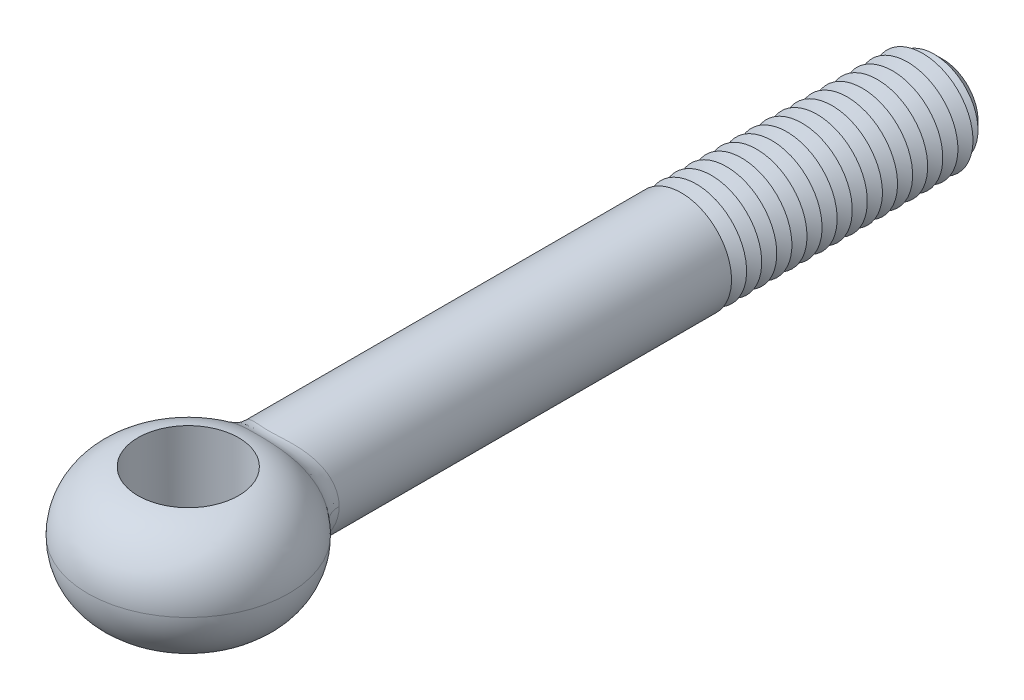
SolidWorks part; units mm, degrees
ref_plane "Front Plane" through (0, 0, 0) normal (0, 0, 1) x (1, 0, 0)
ref_plane "Top Plane" through (0, 0, 0) normal (0, 1, 0) x (1, 0, 0)
ref_plane "Right Plane" through (0, 0, 0) normal (1, 0, 0) x (0, 0, -1)
sketch "Sketch7" plane through (0, 0, 0) normal (0, 1, 0) x (1, 0, 0)
  circle A0 centre (0, 0) radius 10
  dimension "D1" = 20
extrude "Boss-Extrude3" add sketch "Sketch7" along normal mid plane 12
sketch "Sketch8" plane through (0, 0, 0) normal (0, 0, 1) x (1, 0, 0)
  circle A0 centre (0, 0) radius 5
  dimension "D1" = 10
extrude "Boss-Extrude4" add sketch "Sketch8" against normal blind 75
fillet "Fillet5" radius 6 2 edges at (0, -6, 10) (0, 6, 10)
fillet "Fillet6" radius 2.5 2 edges at (-0.0154, -5, -7.3166) (0.0154, 5, -7.3166)
chamfer "Chamfer1" distance 1.5 angle 45 1 edges at (5, 0, -75)
sketch "Sketch10" plane through (0, 0, 0) normal (0, 1, 0) x (1, 0, 0)
  line L0 (0, 28.1405) -> (0, -7.9233) construction
sketch "Sketch11" plane through (0, 0, 0) normal (0, 1, 0) x (1, 0, 0)
  line L0 (-5, 49) -> (-3.701, 49.75)
  line L1 (-5, 73.5) -> (-5, 10) construction
  line L2 (-3.701, 49.75) -> (-5, 50.5)
  line L3 (-5, 50.5) -> (-5, 49)
  line L4 (3.5, 75) -> (-3.5, 75) construction
  dimension "D1" = 1.5
  dimension "D2" = 26
revolve "Cut-Revolve1" cut sketch "Sketch11" angle 360 about L0
pattern_linear "LPattern1" count 17 spacing 1.5 along (0, 0, -1) of "Cut-Revolve1"
sketch "Sketch12" plane through (0, 0, 0) normal (0, 1, 0) x (1, 0, 0)
  circle A0 centre (0, 0) radius 5
  dimension "D1" = 10
extrude "Cut-Extrude1" cut sketch "Sketch12" against normal mid plane 12
